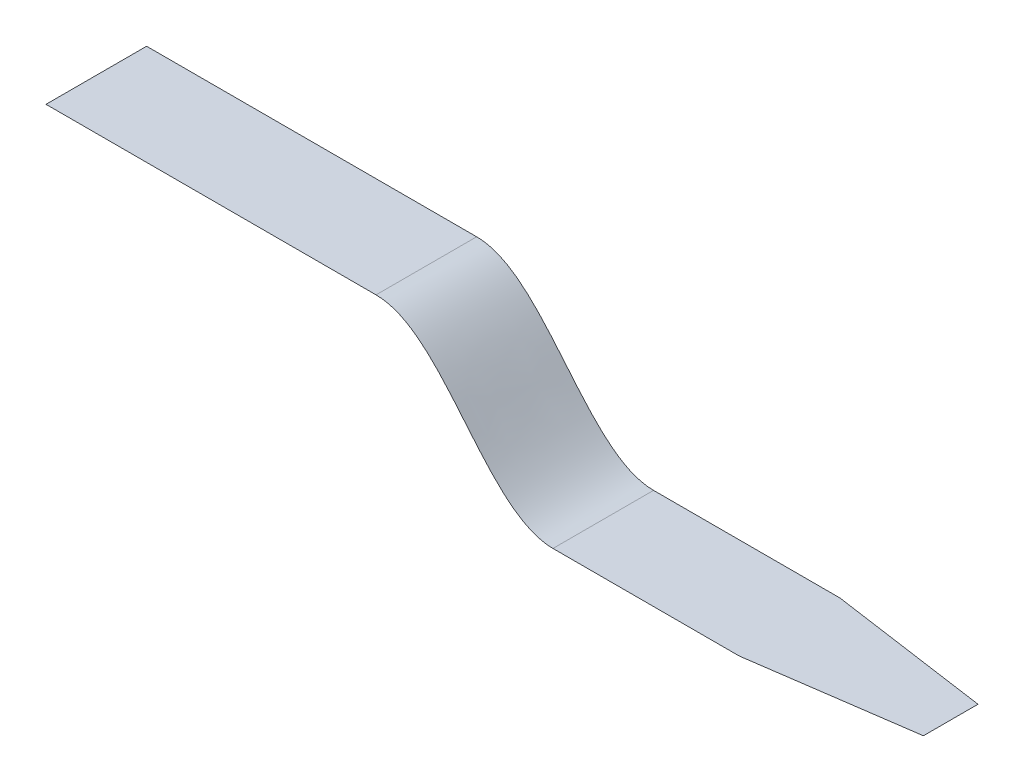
SolidWorks part; units mm, degrees
ref_plane "Vorne" through (0, 0, 0) normal (0, 0, 1) x (1, 0, 0)
ref_plane "Oben" through (0, 0, 0) normal (0, 1, 0) x (1, 0, 0)
ref_plane "Rechts" through (0, 0, 0) normal (1, 0, 0) x (0, 0, -1)
sketch "Skizze1" plane through (0, 0, 0) normal (0, 1, 0) x (1, 0, 0)
  line L0 (22.9165, -29.3286) -> (22.9165, 29.3286)
  line L1 (22.9165, 29.3286) -> (155.3684, 10.4069)
  line L2 (155.3684, 10.4069) -> (155.3684, -10.4069)
  line L3 (155.3684, -10.4069) -> (22.9165, -29.3286)
  line L4 (155.3684, 0) -> (0, 0) construction
surface "Oberfläche-Ebene1" sketch "Skizze1"
ref_plane "Ebene1" through (0, 50, 0) normal (0, 1, 0) x (-1, 0, 0)
sketch "Skizze2" plane through (0, 50, 0) normal (0, 1, 0) x (-1, 0, 0)
  line L0 (170.3385, 0) -> (44.5236, 0) construction
  line L1 (44.5236, -19.1775) -> (170.3385, -19.1775)
  line L2 (44.5236, -19.1775) -> (44.5236, 19.1775)
  line L3 (44.5236, 19.1775) -> (170.3385, 19.1775)
  line L4 (170.3385, -19.1775) -> (170.3385, 19.1775)
surface "Oberfläche-Ebene2" sketch "Skizze2"
surface "Oberfläche-Ausformung1"
sketch "Skizze3" plane through (0, 50, 0) normal (0, 1, 0) x (-1, 0, 0)
  line L0 (-155.3684, 10.4069) -> (-155.3684, -10.4069) construction
  line L1 (44.5236, 19.1775) -> (-155.3684, 19.1775)
  line L2 (44.5236, 19.1775) -> (44.5236, -19.1775) construction
  line L3 (44.5236, -19.1775) -> (-155.3684, -19.1775)
  line L4 (-155.3684, 19.1775) -> (-155.3684, -19.1775)
surface "Oberfläche-Linear austragen1" sketch "Skizze3" parameters "D1"=99.8
surface "Oberfläche-Trimmen1"
delete or keep bodies "Körper-Löschen1" type delete bodies bodies 104
